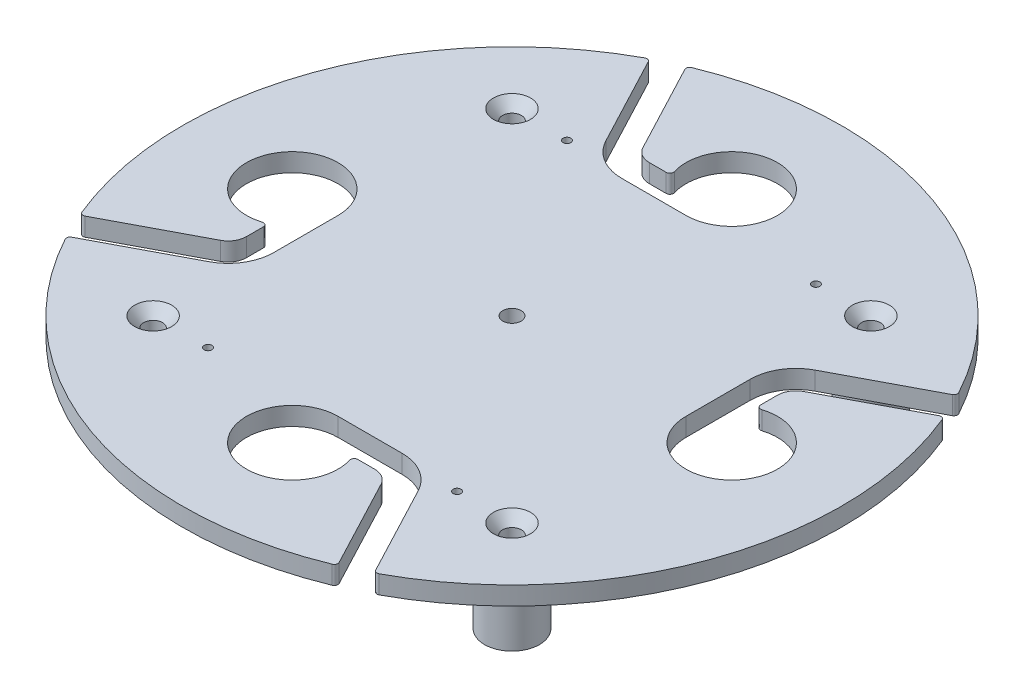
SolidWorks part; units mm, degrees
ref_plane "Front Plane" through (0, 0, 0) normal (0, 0, 1) x (1, 0, 0)
ref_plane "Top Plane" through (0, 0, 0) normal (0, 1, 0) x (1, 0, 0)
ref_plane "Right Plane" through (0, 0, 0) normal (1, 0, 0) x (0, 0, -1)
sketch "Sketch1" plane through (0, 0, 0) normal (0, 1, 0) x (1, 0, 0)
  circle A0 centre (0, 0) radius 114.3
  circle A1 centre (0, 0) radius 3.175
  dimension "D1" = 228.6
  dimension "D2" = 6.35
extrude "Boss-Extrude1" add sketch "Sketch1" along normal blind 6.35
sketch "Sketch2" plane through (0, 6.35, 0) normal (0, 1, 0) x (1, 0, 0)
  line L0 (0, 0) -> (114.3, 0) construction
  line L1 (102.9964, 54.2973) -> (105.8032, 45.0095)
  line L5 (60.325, 0) -> (60.325, 22.225)
  line L6 (68.7968, 36.2681) -> (102.9964, 54.2973)
  line L7 (105.8032, 45.0095) -> (73.2387, 27.8422)
  line L8 (69.85, 22.225) -> (69.85, 16.3751)
  circle A0 centre (0, 0) radius 114.3 construction
  arc A1 (92.075, 0) -> (71.4963, 15.1622) centre (76.2, 0) ccw
  arc A2 (60.325, 0) -> (92.075, 0) centre (76.2, 0) ccw
  arc A3 (73.2387, 27.8422) -> (69.85, 22.225) centre (76.2, 22.225) ccw
  arc A4 (60.325, 22.225) -> (68.7968, 36.2681) centre (76.2, 22.225) cw
  arc A5 (69.85, 16.3751) -> (71.4963, 15.1622) centre (71.12, 16.3751) ccw
  dimension "D1" = 31.75
  dimension "D2" = 76.2
  dimension "D7" = 1.27
  dimension "D4" = 6.35
  dimension "D3" = 22.225
  dimension "D5" = 9.525
extrude "Cut-Extrude1" cut sketch "Sketch2" against normal through all
pattern_circular "CirPattern1" count 4 over 360 about axis through (0, 0, 0) along (0, 1, 0) of "Cut-Extrude1"
hole_wizard "CSK for 1/4 Flat Head Machine Screw1" positions "Sketch4" profile "Sketch3" countersink size "1/4" standard "Ansi Inch"
sketch "Sketch4" plane through (0, 6.35, 0) normal (0, 1, 0) x (-1, 0, 0)
  line L0 (62.23, -62.23) -> (-62.23, -62.23) construction
  line L1 (-62.23, -62.23) -> (-62.23, 62.23) construction
  line L2 (-62.23, 62.23) -> (62.23, 62.23) construction
  line L3 (62.23, 62.23) -> (62.23, -62.23) construction
  line L4 (62.23, -62.23) -> (0, 0) construction
  line L5 (0, 0) -> (-62.23, 62.23) construction
  point P0 (62.23, -62.23)
  point P1 (-62.23, -62.23)
  point P3 (-62.23, 62.23)
  point P5 (62.23, 62.23)
  dimension "D1" = 124.46
  dimension "D2" = 124.46
sketch "Sketch3" plane through (-62.23, 6.35, -62.23) normal (1, 0, 0) x (0, 0, 1)
  line L0 (0, 0) -> (0, 6.35)
  line L1 (0, 6.35) -> (3.2639, 6.35)
  line L2 (3.2639, 6.35) -> (3.2639, 3.6524)
  line L3 (3.2639, 3.6524) -> (6.4389, 0)
  line L5 (6.4389, 0) -> (0, 0)
  line L6 (-3.2639, 3.6524) -> (-6.4389, 0) construction
  line L11 (0, -6.35) -> (0, 107.95) construction
  dimension "Thru Hole Dia." = 6.5278
  dimension "Thru Hole Depth" = 6.35
  dimension "Near C'Sink Dia." = 12.8778
  dimension "Near C'Sink Angle" = 82
sketch "Sketch5" plane through (0, 0, 0) normal (0, -1, 0) x (1, 0, 0)
  circle A0 centre (62.23, 62.23) radius 9.525
  circle A1 centre (62.23, 62.23) radius 3.2639
  circle A2 centre (62.23, 62.23) radius 3.2639 construction
  dimension "D1" = 19.05
extrude "Boss-Extrude2" add sketch "Sketch5" along normal blind 25.4
pattern_circular "CirPattern2" count 4 over 360 about axis through (0, 0, 0) along (0, 1, 0) of "Boss-Extrude2"
fillet "Fillet1" radius 1.27 8 edges at (-101.1102, 3.175, 53.303) (-105.2005, 3.175, 44.6917) (-53.303, 3.175, -101.1102) (-44.6917, 3.175, -105.2005) (101.1102, 3.175, -53.303) (105.2005, 3.175, -44.6917) (53.303, 3.175, 101.1102) (44.6917, 3.175, 105.2005)
hole_wizard "#6-32 Tapped Hole1" positions "Sketch8" profile "Sketch7" tap size "#6-32" standard "Ansi Inch"
sketch "Sketch8" plane through (0, 6.35, 0) normal (0, 1, 0) x (-1, 0, 0)
  line L0 (43.18, -62.23) -> (-43.18, -62.23) construction
  line L1 (-43.18, -62.23) -> (-43.18, 62.23) construction
  line L2 (-43.18, 62.23) -> (43.18, 62.23) construction
  line L3 (43.18, 62.23) -> (43.18, -62.23) construction
  line L5 (43.18, -62.23) -> (-43.18, 62.23) construction
  point P0 (43.18, -62.23)
  point P1 (-43.18, -62.23)
  point P3 (-43.18, 62.23)
  point P5 (43.18, 62.23)
  dimension "D1" = 86.36
  dimension "D2" = 124.46
sketch "Sketch7" plane through (-43.18, 6.35, -62.23) normal (1, 0, 0) x (0, 0, 1)
  line L0 (0, 0) -> (0, 31.75)
  line L1 (0, 31.75) -> (1.3525, 31.75)
  line L2 (1.3525, 31.75) -> (1.3525, 0)
  line L5 (1.3525, 0) -> (0, 0)
  line L11 (0, -6.35) -> (0, 107.95) construction
  dimension "Thru Tap Drill Dia." = 2.7051
  dimension "Thru Tap Drill Depth" = 31.75
